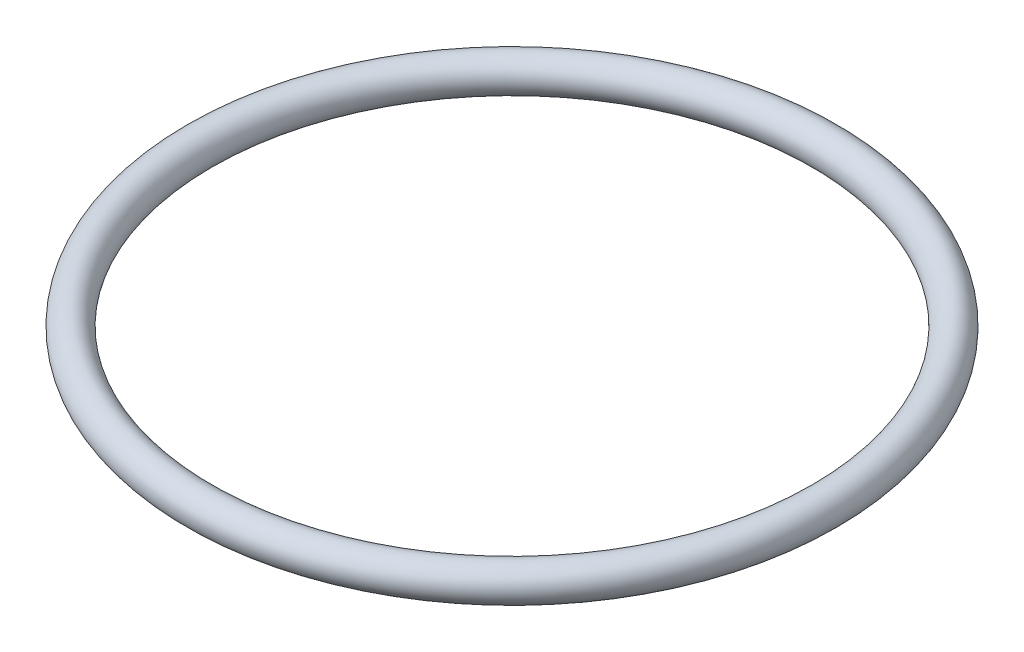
SolidWorks part; units mm, degrees
ref_plane "Face" through (0, 0, 0) normal (0, 0, 1) x (1, 0, 0)
ref_plane "Dessus" through (0, 0, 0) normal (0, 1, 0) x (1, 0, 0)
ref_plane "Droite" through (0, 0, 0) normal (1, 0, 0) x (0, 0, -1)
sketch "Esquisse1" plane through (0, 0, 0) normal (0, 0, 1) x (1, 0, 0)
  line L0 (0, 272.9) -> (0, 287.2533) construction
  line L1 (-33, 272.9) -> (33, 272.9) construction
  circle A1 centre (31.725, 271.135) radius 1.765
revolve "Révolution1" add sketch "Esquisse1" angle 360 about L0
